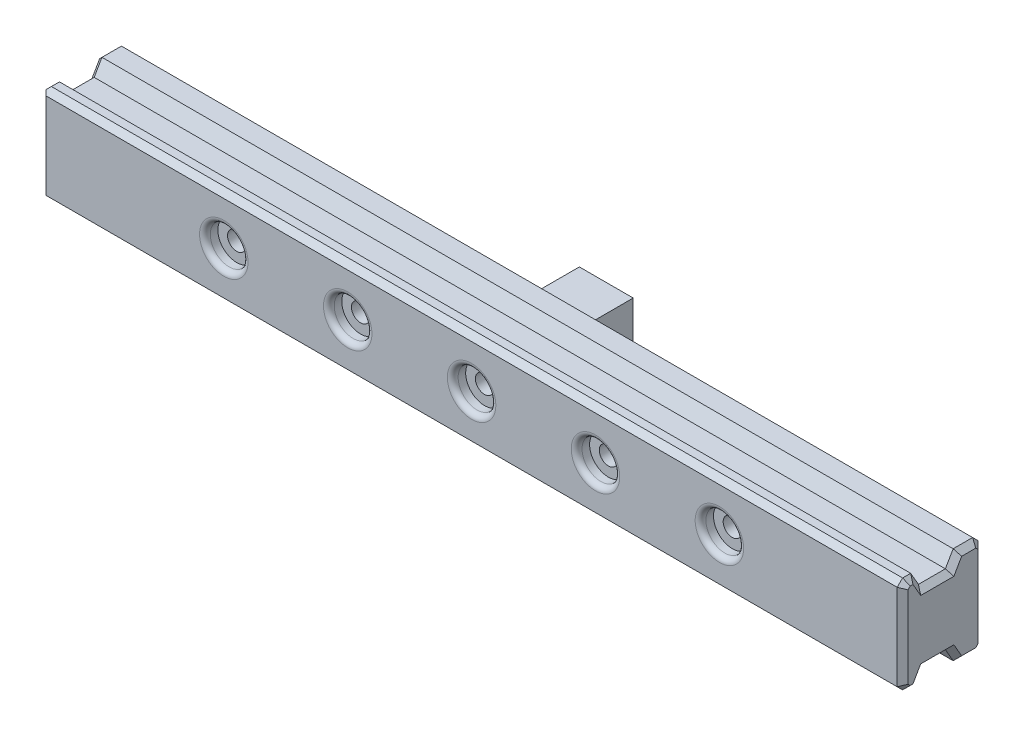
SolidWorks part; units mm, degrees
ref_plane "Płaszczyzna przednia" through (0, 0, 0) normal (0, 0, 1) x (1, 0, 0)
ref_plane "Płaszczyzna górna" through (0, 0, 0) normal (0, 1, 0) x (1, 0, 0)
ref_plane "Płaszczyzna prawa" through (0, 0, 0) normal (1, 0, 0) x (0, 0, -1)
sketch "Szkic1" plane through (0, 0, 0) normal (0, 0, 1) x (1, 0, 0)
  line L1 (-80, 9) -> (80, 9)
  line L2 (-80, 9) -> (-80, -9)
  line L3 (-80, -9) -> (80, -9)
  line L4 (80, 9) -> (80, -9)
  line L5 (-80, 9) -> (80, -9) construction
  line L6 (-80, -9) -> (80, 9) construction
  point P0 (0, 0)
  dimension "D1" = 160
  dimension "D2" = 18
extrude "Dodanie-wyciągnięcie1" add sketch "Szkic1" along normal blind 15
sketch "Szkic2" plane through (80, 0, 0) normal (1, 0, 0) x (0, 0, -1)
  line L1 (-15, 9) -> (0, 9) construction
  line L2 (-12.5, 9) -> (-11.0566, 6.5)
  line L3 (-11.0566, 6.5) -> (-6.0566, 6.5)
  line L4 (-6.0566, 6.5) -> (-4.6132, 9)
  line L5 (-4.6132, 9) -> (-12.5, 9)
  line L6 (-12.5, 9) -> (-12.5, -9) construction
  line L7 (-15, -9) -> (0, -9) construction
  line L8 (-4.6132, 9) -> (-4.6132, -2.1585) construction
  line L9 (0, 0) -> (-3.0897, 0) construction
  line L10 (-4.6132, -9) -> (-12.5, -9)
  line L11 (-6.0566, -6.5) -> (-4.6132, -9)
  line L12 (-11.0566, -6.5) -> (-6.0566, -6.5)
  line L13 (-12.5, -9) -> (-11.0566, -6.5)
  dimension "D1" = 2.5
  dimension "D2" = 30
  dimension "D4" = 30
  dimension "D5" = 5
extrude "Wytnij-wyciągnięcie1" cut sketch "Szkic2" against normal up to next
chamfer "Sfazowanie1" distance 1 angle 45 4 edges at (0, -9, 0) (0, 9, 0) (0, -9, 15) (0, 9, 15)
sketch "Szkic4" plane through (0, 0, 0) normal (0, 0, -1) x (-1, 0, 0)
  line L1 (-5, 5) -> (5, 5)
  line L2 (-5, 5) -> (-5, -5)
  line L3 (-5, -5) -> (5, -5)
  line L4 (5, 5) -> (5, -5)
  line L5 (-5, 5) -> (5, -5) construction
  line L6 (-5, -5) -> (5, 5) construction
  point P0 (0, 0)
  dimension "D1" = 10
  dimension "D2" = 10
extrude "Dodanie-wyciągnięcie2" add sketch "Szkic4" along normal blind 10
chamfer "Sfazowanie2" distance 1 angle 45 28 edges at (80, -7.75, 5.3349) (80, -6.5, 8.5566) (80, -7.75, 11.7783) (80, -9, 13.25) (80, -8.5, 14.5) (80, 0, 15) (80, 8.5, 14.5) (80, 9, 13.25) (80, 7.75, 11.7783) (80, 6.5, 8.5566) (80, 7.75, 5.3349) (80, 9, 2.8066) (80, 8.5, 0.5) (80, 0, 0) (80, -8.5, 0.5) (80, -9, 2.8066) (-80, -9, 13.25) (-80, -7.75, 11.7783) (-80, -6.5, 8.5566) (-80, -7.75, 5.3349) (-80, -9, 2.8066) (-80, 9, 13.25) (-80, 9, 2.8066) (-80, 7.75, 11.7783) (-80, 7.75, 5.3349) (-80, 6.5, 8.5566) (-80, 0, 15) (-80, 0, 0)
sketch "Szkic5" plane through (0, 0, 15) normal (0, 0, 1) x (1, 0, 0)
  point P0 (0, 0)
hole_wizard "Pogłębienie walcowe pod M3 Śrubę z łbem stożkowym ściętym1" positions "Szkic 3D2" profile "Szkic7" counterbore size "M3" standard "ISO"
sketch3d "Szkic 3D2"
  point P0 (0, 0, 15)
sketch "Szkic7" plane through (0, 0, 15) normal (1, 0, 0) x (0, -1, 0)
  line L0 (0, 0) -> (0, 25)
  line L1 (0, 25) -> (1.7, 25)
  line L3 (1.7, 25) -> (1.7, 2.4)
  line L4 (1.7, 2.4) -> (3.5, 2.4)
  line L5 (3.5, 2.4) -> (3.5, 0)
  line L7 (3.5, 0) -> (0, 0)
  line L11 (0, -6.35) -> (0, 107.95) construction
  dimension "Średnica otworu na wylot" = 3.4
  dimension "Głębokość otworu na wylot" = 25
  dimension "Średnica pogłębienia walcowego" = 7
  dimension "Głębokość pogłębienia walcowego" = 2.4
pattern_linear "Szyk liniowy1" count 3 spacing 23 along (1, 0, 0) of "Pogłębienie walcowe pod M3 Śrubę z łbem stożkowym ściętym1"
pattern_linear "Szyk liniowy2" count 3 spacing 23 along (-1, 0, 0) of "Szyk liniowy1"
fillet "Zaokrąglenie1" radius 1 5 edges at (49.5, 0, 15) (26.5, 0, 15) (3.5, 0, 15) (-19.5, 0, 15) (-42.5, 0, 15)
